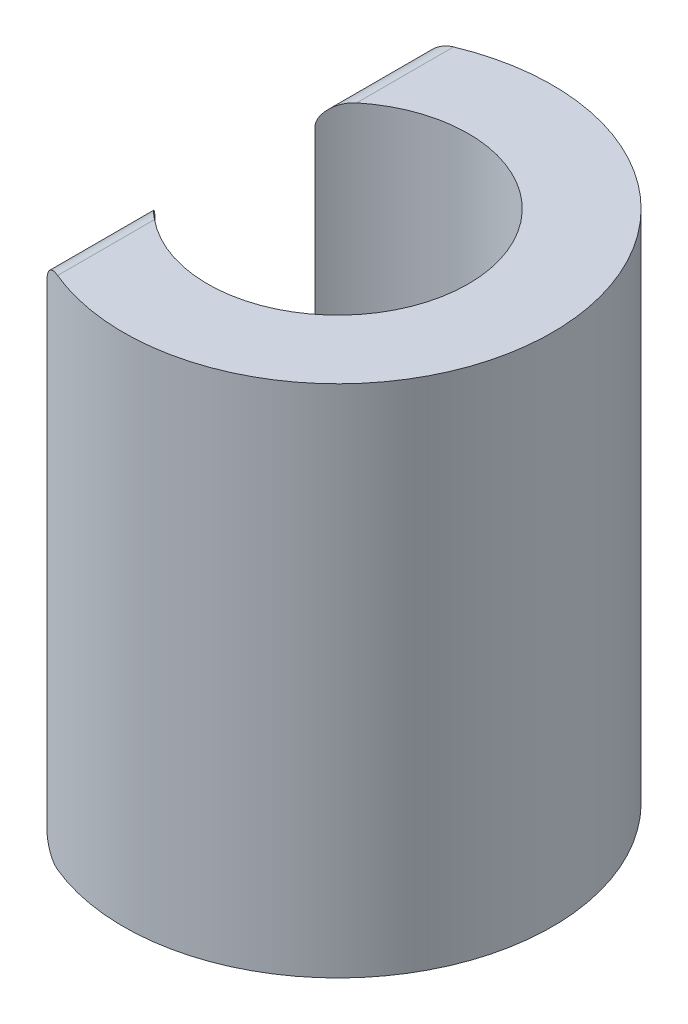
SolidWorks part; units mm, degrees
ref_plane "Front Plane" through (0, 0, 0) normal (0, 0, 1) x (1, 0, 0)
ref_plane "Top Plane" through (0, 0, 0) normal (0, 1, 0) x (1, 0, 0)
ref_plane "Right Plane" through (0, 0, 0) normal (1, 0, 0) x (0, 0, -1)
sketch "Sketch1" plane through (0, 0, 0) normal (0, 1, 0) x (1, 0, 0)
  line L0 (-3.81, 6.9633) -> (-3.81, 2.9621)
  line L1 (-3.81, -2.9621) -> (-3.81, -6.9633)
  arc A0 (-3.81, -6.9633) -> (-3.81, 6.9633) centre (0, 0) ccw
  arc A1 (-3.81, -2.9621) -> (-3.81, 2.9621) centre (0, 0) ccw
  arc A6 (2.1786, -7.6327) -> (6.4273, -4.6577) centre (0, 0) ccw construction
  dimension "D1" = 9.652
  dimension "D2" = 3.81
extrude "Boss-Extrude1" add sketch "Sketch1" along normal blind 19.05
fillet "Fillet1" radius 0.762 4 edges at (-3.81, 19.05, -4.9627) (-3.81, 19.05, 4.9627) (-3.81, 0, -4.9627) (-3.81, 0, 4.9627)
